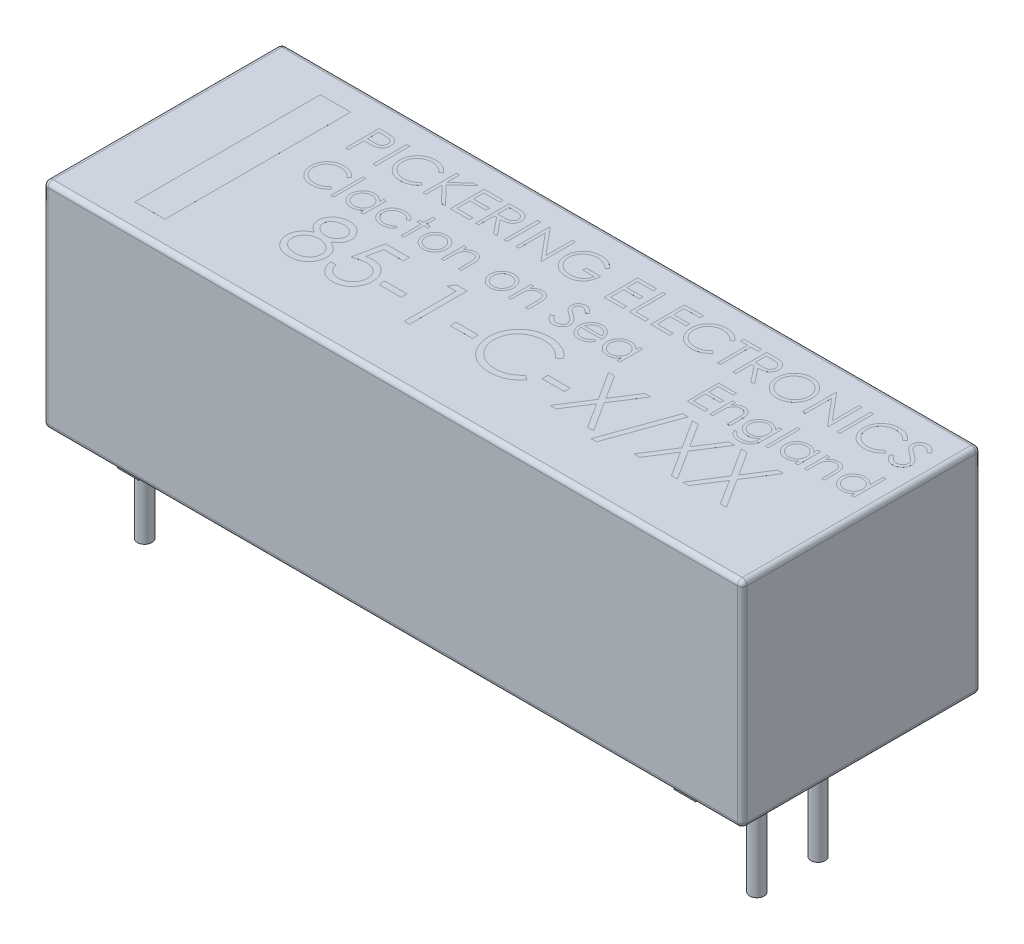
SolidWorks part; units mm, degrees
ref_plane "Front Plane" through (0, 0, 0) normal (0, 0, 1) x (1, 0, 0)
ref_plane "Top Plane" through (0, 0, 0) normal (0, 1, 0) x (1, 0, 0)
ref_plane "Right Plane" through (0, 0, 0) normal (1, 0, 0) x (0, 0, -1)
sketch "Sketch2" plane through (0, 0, 0) normal (0, 1, 0) x (1, 0, 0)
  line L1 (14.5, -4.95) -> (-14.5, -4.95)
  line L2 (14.5, -4.95) -> (14.5, 4.95)
  line L3 (14.5, 4.95) -> (-14.5, 4.95)
  line L4 (-14.5, -4.95) -> (-14.5, 4.95)
  line L5 (14.5, -4.95) -> (-14.5, 4.95) construction
  line L6 (14.5, 4.95) -> (-14.5, -4.95) construction
  point P0 (0, 0)
  dimension "D1" = 9.9
  dimension "D2" = 29
extrude "Main Body" add sketch "Sketch2" along normal blind 8.89 draft 0.023
sketch "Sketch3"
  dimension "D1" = 1.25
  dimension "D2" = 7.7
  dimension "D3" = 1.0965
  dimension "D4" = 2.7
  dimension "D5" = 1.4
  dimension "D6" = 2
extrude "Lettering" add sketch "Sketch3" along normal blind 0.0001
sketch "Sketch4" plane through (0, 0, 0) normal (0, -1, 0) x (1, 0, 0)
  line L0 (-14.5, -4.95) -> (-14.5, 4.95) construction
  line L1 (-12, 4.375) -> (-11.1, 4.375)
  line L2 (-12, 4.375) -> (-12, -4.375)
  line L3 (-12, -4.375) -> (-11.1, -4.375)
  line L4 (-11.1, 4.375) -> (-11.1, -4.375)
  line L5 (-14.5, 4.95) -> (14.5, 4.95) construction
  dimension "D1" = 8.75
  dimension "D2" = 0.9
  dimension "D3" = 2.5
  dimension "D4" = 0.575
extrude "Bobbin feet" add sketch "Sketch4" along normal blind 0.51
sketch "Sketch5" plane through (0, -0.51, 0) normal (0, -1, 0) x (1, 0, 0)
  line L0 (-11.1, -4.375) -> (-11.1, 4.375) construction
  line L1 (-11.1, -2.9375) -> (-12, -2.9375)
  line L2 (-11.1, -2.9375) -> (-11.1, -1.9375)
  line L3 (-11.1, -1.9375) -> (-12, -1.9375)
  line L4 (-12, -2.9375) -> (-12, -1.9375)
  line L5 (-12, 4.375) -> (-12, -4.375) construction
  line L6 (-12, 4.375) -> (-12, -4.375) construction
  line L7 (-12, -0.5) -> (-11.1, -0.5)
  line L8 (-12, -0.5) -> (-12, 0.5)
  line L9 (-12, 0.5) -> (-11.1, 0.5)
  line L10 (-11.1, -0.5) -> (-11.1, 0.5)
  line L11 (-11.1, 1.9375) -> (-12, 1.9375)
  line L12 (-11.1, 1.9375) -> (-11.1, 2.9375)
  line L13 (-11.1, 2.9375) -> (-12, 2.9375)
  line L14 (-12, 1.9375) -> (-12, 2.9375)
  line L15 (-12, -4.375) -> (-11.1, -4.375) construction
  dimension "D1" = 1.4375
  dimension "D2" = 1
  dimension "D3" = 1.4375
  dimension "D4" = 1
  dimension "D5" = 1
  dimension "D6" = 1.4375
extrude "Bobbin feet cut" cut sketch "Sketch5" against normal up to surface (0.51 mm away)
sketch "Sketch8" plane through (0, 0, 0) normal (0, -1, 0) x (1, 0, 0)
  line L0 (-14.5, -4.95) -> (-14.5, 4.95) construction
  line L1 (-12, -4.375) -> (-13.925, -4.375)
  line L2 (-12, -4.375) -> (-12, -2.9375)
  line L3 (-12, -2.9375) -> (-13.925, -2.9375)
  line L4 (-13.925, -4.375) -> (-13.925, -2.9375)
  line L5 (-12, -2.9375) -> (-11.1, -2.9375) construction
  dimension "D1" = 0.575
extrude "Extrude5" add sketch "Sketch8" along normal blind 0.1
pattern_linear "LPattern1" count 4 spacing 2.4385 along (0, 0, 1) of "Extrude5"
mirror "Mirror1" about plane through (0, 0, 0) normal (1, 0, 0) of "Extrude5", "Bobbin feet cut", "Bobbin feet", "LPattern1"
sketch "Sketch9" plane through (0, 0, 0) normal (0, -1, 0) x (1, 0, 0)
  line L1 (14.5, 4.95) -> (14.5, -4.95) construction
  circle A0 centre (12.7, 2.54) radius 0.3
  circle A1 centre (12.7, 0) radius 0.2963
  dimension "D1" = 0.6
  dimension "D2" = 2.54
  dimension "D4" = 1.8
extrude "Pins" add sketch "Sketch9" along normal blind 4.31
sketch "Sketch10" plane through (0, 0, 0) normal (0, -1, 0) x (1, 0, 0)
  line L0 (14.5, -4.95) -> (-14.5, -4.95) construction
  line L1 (-14.5, -4.95) -> (-14.5, 4.95) construction
  circle A0 centre (-12.7, -2.54) radius 0.3
  circle A1 centre (-12.7, 0) radius 0.3
  circle A2 centre (-12.7, 2.54) radius 0.3
  dimension "D1" = 0.6
  dimension "D2" = 0.6
  dimension "D3" = 0.6
  dimension "D4" = 2.41
  dimension "D5" = 2.54
  dimension "D6" = 2.54
  dimension "D7" = 1.8
extrude "Extrude7" add sketch "Sketch10" along normal blind 4.31
fillet "Fillet1" radius 0.2 12 edges at (0, 8.89, -4.9465) (0, 0, -4.95) (-14.4983, 4.445, -4.9483) (-14.4965, 8.89, 0) (-14.5, 0, 0) (-14.4983, 4.445, 4.9483) (0, 8.89, 4.9465) (0, 0, 4.95) (14.4983, 4.445, 4.9483) (14.4965, 8.89, 0) (14.4983, 4.445, -4.9483) (14.5, 0, 0)
